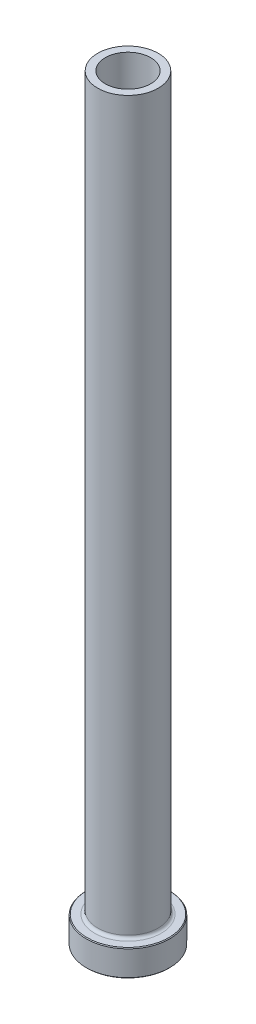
SolidWorks part; units mm, degrees
ref_plane "Front Plane" through (0, 0, 0) normal (0, 0, 1) x (1, 0, 0)
ref_plane "Top Plane" through (0, 0, 0) normal (0, 1, 0) x (1, 0, 0)
ref_plane "Right Plane" through (0, 0, 0) normal (1, 0, 0) x (0, 0, -1)
sketch "Sketch1" plane through (0, 0, 0) normal (0, 0, 1) x (1, 0, 0)
  line L0 (-6, 200) -> (-8, 200)
  line L1 (-8, 200) -> (-8, 7)
  line L2 (-8, 7) -> (-11, 7)
  line L3 (-11, 7) -> (-11, 0)
  line L4 (12.1, 0) -> (-12.1, 0) construction
  line L5 (-11, 0) -> (-6.25, 0)
  line L6 (-6, 145) -> (-6, 200)
  line L7 (0, 92.1877) -> (0, -15.5353) construction
  line L8 (0, -12.1) -> (0, 12.1) construction
  line L9 (-6, 145) -> (-6.25, 133)
  line L10 (-6.25, 133) -> (-6.25, 0)
  dimension "D1" = 0.25
  dimension "ID" = 12
  dimension "OD" = 16
  dimension "L" = 200
  dimension "H" = 22
  dimension "T" = 7
  dimension "N" = 55
  dimension "D2" = 12
revolve "Revolve1" add sketch "Sketch1" angle 360 about L7
fillet "Fillet1" radius 0.8 1 edges at (0, 7, 8)
chamfer "Chamfer1" distance 0.2 angle 45 2 edges at (0, 7, 11) (0, 0, 11)
chamfer "Chamfer3" distance 0.5 angle 45 1 edges at (0, 0, 6.25)
